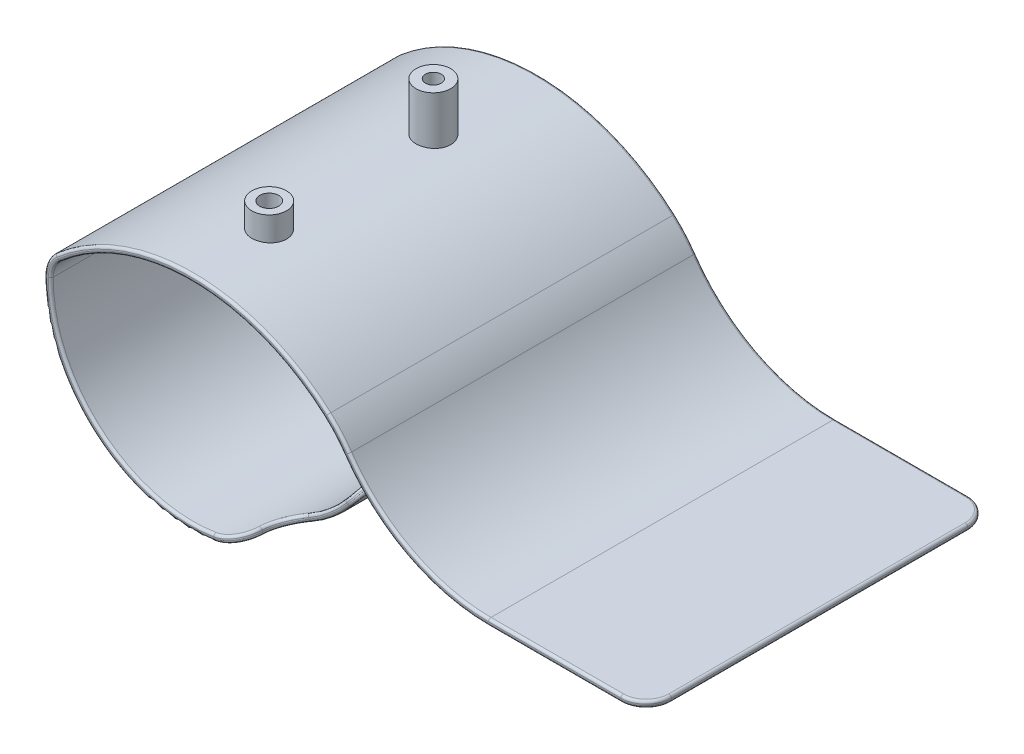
SolidWorks part; units mm, degrees
ref_plane "Plan de face" through (0, 0, 0) normal (0, 0, 1) x (1, 0, 0)
ref_plane "Plan de dessus" through (0, 0, 0) normal (0, 1, 0) x (1, 0, 0)
ref_plane "Plan de droite" through (0, 0, 0) normal (1, 0, 0) x (0, 0, -1)
sketch "Esquisse1" plane through (0, 0, 0) normal (0, 0, 1) x (1, 0, 0)
  line L0 (47.2497, -14.7497) -> (72.2497, -14.7497)
  line L1 (47.2497, -15.7497) -> (72.2497, -15.7497)
  line L2 (72.2497, -14.7497) -> (72.2497, -15.7497)
  line L3 (19.2143, -14.0934) -> (20.0803, -14.5934)
  arc A0 (21.8383, 0.673) -> (-23.0475, -0.4622) centre (0, -23.8) ccw construction
  arc A1 (18.4116, -17.094) -> (20.0803, -14.5934) centre (0, -3) ccw construction
  arc A2 (8.7254, -24.4824) -> (18.4116, -17.094) centre (0, -3) ccw construction
  arc A3 (7.7908, -24.8387) -> (8.7254, -24.4824) centre (0, -3) ccw construction
  arc A4 (6.8417, -25.1544) -> (7.7908, -24.8387) centre (0, -3) ccw construction
  arc A5 (-23.0475, -0.4622) -> (6.8417, -25.1544) centre (0, -3) ccw construction
  arc A6 (21.8383, 0.673) -> (-21.4561, 1.0088) centre (0, -23.8) ccw
  arc A7 (18.4116, -17.094) -> (20.0803, -14.5934) centre (0, -3) ccw
  arc A8 (8.7254, -24.4824) -> (18.4116, -17.094) centre (0, -3) ccw
  arc A9 (7.7908, -24.8387) -> (8.7254, -24.4824) centre (0, -3) ccw
  arc A10 (6.8417, -25.1544) -> (7.7908, -24.8387) centre (0, -3) ccw
  arc A11 (-23.185, -2.7107) -> (6.8417, -25.1544) centre (0, -3) ccw
  arc A12 (21.8383, 0.673) -> (25.1389, -3.0828) centre (8.076, -14.7497) cw
  arc A13 (25.1389, -3.0828) -> (47.2497, -14.7497) centre (47.2497, 12.0356) ccw
  arc A14 (-21.4561, 1.0088) -> (-23.185, -2.7107) centre (-18.1854, -2.773) ccw
  arc A15 (17.6175, -16.4862) -> (19.2143, -14.0934) centre (0, -3) ccw
  arc A16 (8.3491, -23.5559) -> (17.6175, -16.4862) centre (0, -3) ccw
  arc A17 (7.4548, -23.8969) -> (8.3491, -23.5559) centre (0, -3) ccw
  arc A18 (6.5466, -24.1989) -> (7.4548, -23.8969) centre (0, -3) ccw
  arc A19 (-22.185, -2.7231) -> (6.5466, -24.1989) centre (0, -3) ccw
  arc A20 (-20.802, 0.2524) -> (-22.185, -2.7231) centre (-18.1854, -2.773) ccw
  arc A21 (21.1725, -0.0731) -> (-20.802, 0.2524) centre (0, -23.8) ccw
  arc A22 (21.1725, -0.0731) -> (24.3135, -3.6472) centre (8.076, -14.7497) cw
  arc A23 (24.3135, -3.6472) -> (47.2497, -15.7497) centre (47.2497, 12.0356) ccw
  dimension "D1" = 25
  dimension "D4" = 5
  dimension "D2" = 5
  dimension "D3" = 25
  dimension "D5" = 1
extrude "Extrusion1" add sketch "Esquisse1" along normal up to surface (55 mm away)
sketch "Esquisse2" plane through (0, 0, 55) normal (0, 0, 1) x (1, 0, 0)
  line L0 (7.4548, -23.8969) -> (7.7908, -24.8387)
  line L1 (7.7908, -24.8387) -> (8.1268, -25.7806) construction
  line L4 (20.0803, -14.5934) -> (19.2143, -14.0934)
  line L5 (47.2497, -15.7497) -> (72.2497, -15.7497)
  line L6 (72.2497, -15.7497) -> (72.2497, -14.7497)
  line L7 (72.2497, -14.7497) -> (47.2497, -14.7497)
  line L8 (20.0803, -14.5934) -> (19.2143, -14.0934)
  arc A10 (25.1389, -3.0828) -> (47.2497, -14.7497) centre (47.2497, 12.0356) ccw
  arc A11 (25.1389, -3.0828) -> (21.8383, 0.673) centre (8.076, -14.7497) ccw
  arc A12 (21.8383, 0.673) -> (-21.4561, 1.0088) centre (0, -23.8) ccw
  arc A13 (-21.4561, 1.0088) -> (-23.185, -2.7107) centre (-18.1854, -2.773) ccw
  arc A14 (-23.185, -2.7107) -> (20.0803, -14.5934) centre (0, -3) ccw
  arc A15 (-22.185, -2.7231) -> (19.2143, -14.0934) centre (0, -3) ccw
  arc A16 (-20.802, 0.2524) -> (-22.185, -2.7231) centre (-18.1854, -2.773) ccw
  arc A17 (21.1725, -0.0731) -> (-20.802, 0.2524) centre (0, -23.8) ccw
  arc A18 (24.3135, -3.6472) -> (21.1725, -0.0731) centre (8.076, -14.7497) ccw
  arc A19 (24.3135, -3.6472) -> (47.2497, -15.7497) centre (47.2497, 12.0356) ccw
  arc A24 (7.7908, -24.8387) -> (20.0803, -14.5934) centre (0, -3) ccw
  arc A25 (7.4548, -23.8969) -> (19.2143, -14.0934) centre (0, -3) ccw
  dimension "D1" = 0
extrude "Enlèv. mat.-Extru.1" cut sketch "Esquisse2" against normal up to surface (7.5 mm away)
fillet "Congé1" radius 4 1 edges at (19.6473, -14.3434, 0)
fillet "Congé2" radius 4 2 edges at (7.6228, -24.3678, 55) (19.6473, -14.3434, 47.5)
fillet "Congé3" radius 4 1 edges at (7.6228, -24.3678, 47.5)
fillet "Congé4" radius 4 2 edges at (72.2497, -15.2497, 0) (72.2497, -15.2497, 55)
fillet "Congé5" radius 0.4 42 edges at (72.2497, -14.7497, 27.5) (71.0781, -14.7497, 53.8284) (57.7497, -14.7497, 55) (34.7497, -11.6541, 55) (23.6026, -1.1047, 55) (0.2544, 8.999, 55) (-22.7195, -0.6655, 55) (-15.061, -20.6293, 55) (6.9601, -25.1175, 53.4982) (9.1891, -24.2882, 48.3634) (14.8412, -20.8148, 47.5) (19.628, -15.3438, 45.9982) (20.0803, -14.5934, 23.75) (19.2785, -15.8828, 0.8635) (-8.0536, -24.7432, 0) (-22.7195, -0.6655, 0) (0.2544, 8.999, 0) (23.6026, -1.1047, 0) (34.7497, -11.6541, 0) (57.7497, -14.7497, 0) (34.283, -12.5385, 0) (22.8515, -1.7648, 0) (0.2466, 7.999, 0) (-21.8127, -1.087, 0) (-7.7884, -23.7748, 0) (18.7613, -14.8434, 1.5019) (19.2143, -14.0934, 23.75) (18.4097, -15.3829, 46.6377) (14.2008, -20.0467, 47.5) (8.4096, -23.5312, 48.812) (6.0065, -24.3582, 54.1377) (-14.478, -19.812, 55) (-21.8127, -1.087, 55) (0.2466, 7.999, 55) (22.8515, -1.7648, 55) (34.283, -12.5385, 55) (57.7497, -15.7497, 55) (71.0781, -15.7497, 53.8284) (72.2497, -15.7497, 27.5) (71.0781, -15.7497, 1.1716) (71.0781, -14.7497, 1.1716) (57.7497, -15.7497, 0)
sketch "Esquisse5" plane through (0, 12.7837, 0) normal (0, -1, 0) x (1, 0, 0)
  circle A0 centre (-0.0485, 42.5) radius 1.5 construction
  circle A1 centre (-0.0485, 42.5) radius 1.5
  circle A2 centre (-0.0485, 42.5) radius 2.75
  dimension "D1" = 5.5
extrude "Extrusion2" add sketch "Esquisse5" along normal up to surface (3.8159 mm away)
sketch "Esquisse6" plane through (0, 17.5837, 0) normal (0, -1, 0) x (1, 0, 0)
  circle A0 centre (0, 16.5) radius 1.25 construction
  circle A1 centre (0, 16.5) radius 1.25
  circle A2 centre (0, 16.5) radius 2.75
  dimension "D1" = 5.5
extrude "Extrusion3" add sketch "Esquisse6" along normal up to surface (7.5837 mm away) from offset 1
